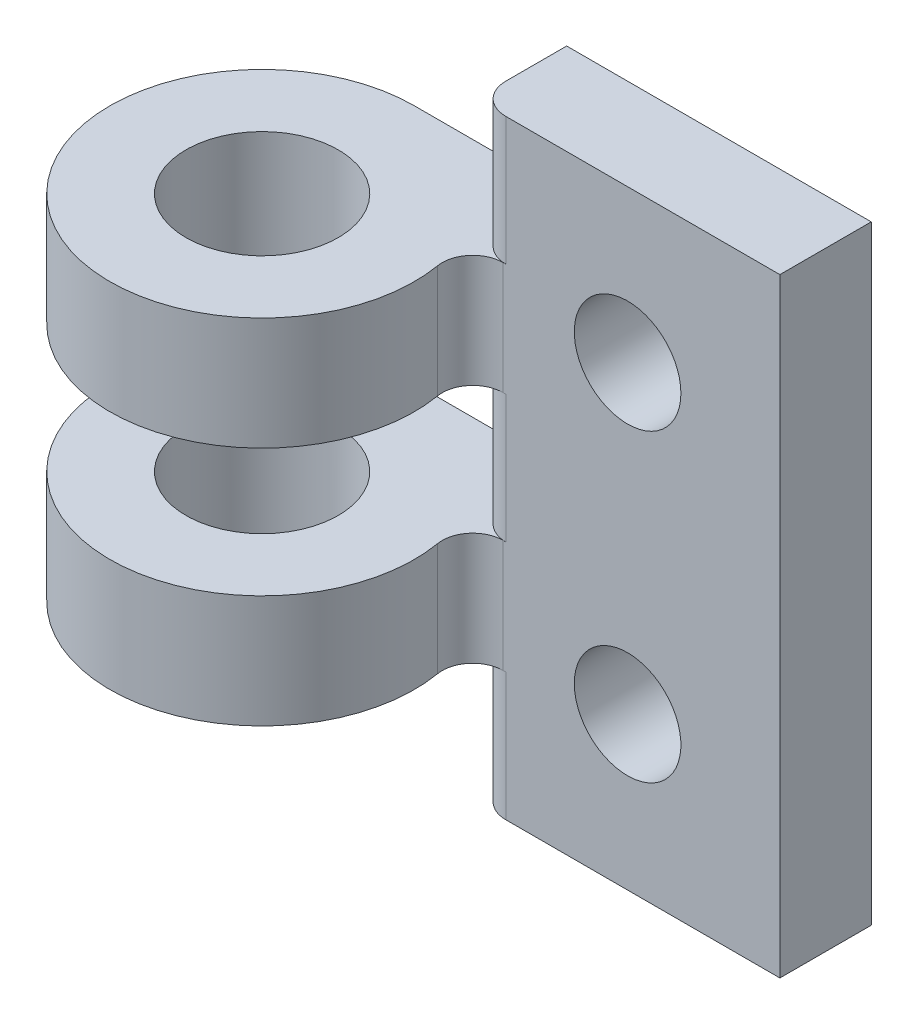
SolidWorks part; units mm, degrees
ref_plane "Alzado" through (0, 0, 0) normal (0, 0, 1) x (1, 0, 0)
ref_plane "Planta" through (0, 0, 0) normal (0, 1, 0) x (1, 0, 0)
ref_plane "Vista lateral" through (0, 0, 0) normal (1, 0, 0) x (0, 0, -1)
sketch "Sketch1" plane through (0, 0, 0) normal (0, 0, 1) x (1, 0, 0)
  line L0 (0, 0) -> (5, 0) construction
  line L1 (-5, -10) -> (5, -10)
  line L2 (-5, -10) -> (-5, 10)
  line L3 (-5, 10) -> (5, 10)
  line L4 (5, -10) -> (5, 10)
  line L5 (-5, -10) -> (5, 10) construction
  line L6 (-5, 10) -> (5, -10) construction
  line L7 (0, 0) -> (0, 5) construction
  circle A0 centre (0, 5) radius 1.75
  circle A1 centre (0, -5) radius 1.75
  point P0 (0, 0)
  dimension "D4" = 3.5
  dimension "D1" = 10
  dimension "D2" = 20
  dimension "D3" = 5
extrude "Boss-Extrude1" add sketch "Sketch1" along normal mid plane 3
sketch "Sketch2" plane through (0, 0, 0) normal (0, 1, 0) x (1, 0, 0)
  line L0 (0, 1.5) -> (-10, 1.5) construction
  line L1 (-10, 1.5) -> (-15, 1.5) construction
  line L4 (-5, 1.5) -> (-5, -1.5)
  line L6 (-15, 1.5) -> (-15, -3.5) construction
  line L7 (-10, 1.5) -> (-5, 1.5)
  line L8 (5, -1.5) -> (-5, -1.5) construction
  line L9 (-5.4174, -1.5) -> (-5, -1.5)
  arc A0 (-10, 1.5) -> (-5.4174, -1.5) centre (-10, -3.5) ccw
  point P2 (0, 0)
  point P10 (-5, -1.4223)
  dimension "D3" = 10
  dimension "D1" = 10
  dimension "D2" = 5
extrude "Boss-Extrude2" add sketch "Sketch2" along normal mid plane 20
sketch "Sketch3" plane through (0, 0, 1.5) normal (0, 0, 1) x (1, 0, 0)
  line L0 (-15, 10) -> (-15, -10) construction
  line L1 (-15, 2.1) -> (-5, 2.1)
  line L2 (-15, 2.1) -> (-15, -2.1)
  line L3 (-15, -2.1) -> (-5, -2.1)
  line L4 (-5, 2.1) -> (-5, -2.1)
  line L6 (0, 0) -> (1.8276, 0) construction
  line L7 (-15, 10) -> (-5, 10)
  line L8 (-15, 10) -> (-15, 5.8)
  line L9 (-15, 5.8) -> (-5, 5.8)
  line L10 (-5, 10) -> (-5, 5.8)
  line L11 (-5, -10) -> (-5, -5.8)
  line L12 (-15, -5.8) -> (-5, -5.8)
  line L13 (-15, -10) -> (-15, -5.8)
  line L14 (-15, -10) -> (-5, -10)
  line L16 (-5, -10) -> (-5, 10) construction
  point P8 (-5, 0)
  point P21 (0, 0)
  point P24 (0, 0)
  dimension "D1" = 4.2
  dimension "D2" = 4.2
extrude "Cut-Extrude1" cut sketch "Sketch3" against normal mid plane 20
sketch "Sketch4" plane through (0, 5.8, 0) normal (0, 1, 0) x (1, 0, 0)
  circle A0 centre (-10, -3.5) radius 2.5
  dimension "D1" = 5
extrude "Cut-Extrude2" cut sketch "Sketch4" against normal blind 20
fillet "Fillet1" radius 1 3 edges at (-5, -7.9, 1.5) (-5, 0, 1.5) (-5, 7.9, 1.5)
fillet "Fillet2" radius 1 2 edges at (-5.4174, -3.95, 1.5) (-5.4174, 3.95, 1.5)
